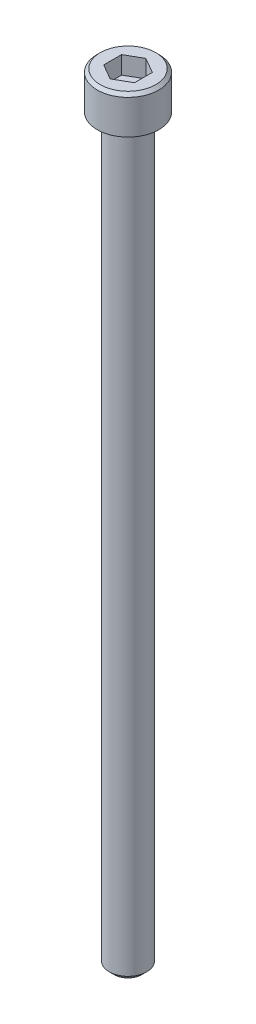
SolidWorks part; units mm, degrees
ref_plane "Front" through (0, 0, 0) normal (0, 0, 1) x (1, 0, 0)
ref_plane "Top" through (0, 0, 0) normal (0, 1, 0) x (1, 0, 0)
ref_plane "Right" through (0, 0, 0) normal (1, 0, 0) x (0, 0, -1)
sketch "Sketch1" plane through (0, 0, 0) normal (0, 0, 1) x (1, 0, 0)
  line L0 (0, 0) -> (3.9688, 0)
  line L1 (3.9688, 0) -> (3.9688, 4.4291)
  line L2 (3.9688, 4.4291) -> (3.5719, 4.826)
  line L3 (3.5719, 4.826) -> (0, 4.826)
  line L4 (0, 4.826) -> (0, 0)
  line L5 (0, 0) -> (0, 100) construction
revolve "Base-Revolve" add sketch "Sketch1" angle 360 about L5
sketch "Sketch2" plane through (0, 0, 0) normal (0, 0, 1) x (1, 0, 0)
  line L0 (0, 0) -> (0, 100) construction
  line L1 (0, -95.25) -> (1.7831, -95.25)
  line L2 (1.7831, -95.25) -> (2.413, -94.6201)
  line L3 (2.413, -94.6201) -> (2.413, 0)
  line L4 (2.413, 0) -> (0, 0)
  line L5 (0, 0) -> (0, -95.25)
  line L6 (-3.9688, 0) -> (3.9688, 0) construction
  dimension "D1" = 94.6201
  dimension "D2" = 4.826
revolve "Boss-Revolve1" add sketch "Sketch2" angle 360 about L0
ref_plane "Plane4" through (0, 4.826, 0) normal (0, 1, 0) x (-1, 0, 0)
sketch "Sketch3" plane through (0, 4.826, 0) normal (0, 1, 0) x (-1, 0, 0)
  line L0 (1.985, 1.146) -> (0, 2.2921)
  line L1 (0, 2.2921) -> (-1.985, 1.146)
  line L2 (-1.985, 1.146) -> (-1.985, -1.146)
  line L3 (-1.985, -1.146) -> (0, -2.2921)
  line L4 (0, -2.2921) -> (1.985, -1.146)
  line L5 (1.985, -1.146) -> (1.985, 1.146)
extrude "Cut-Extrude1" cut sketch "Sketch3" against normal blind 2.286
